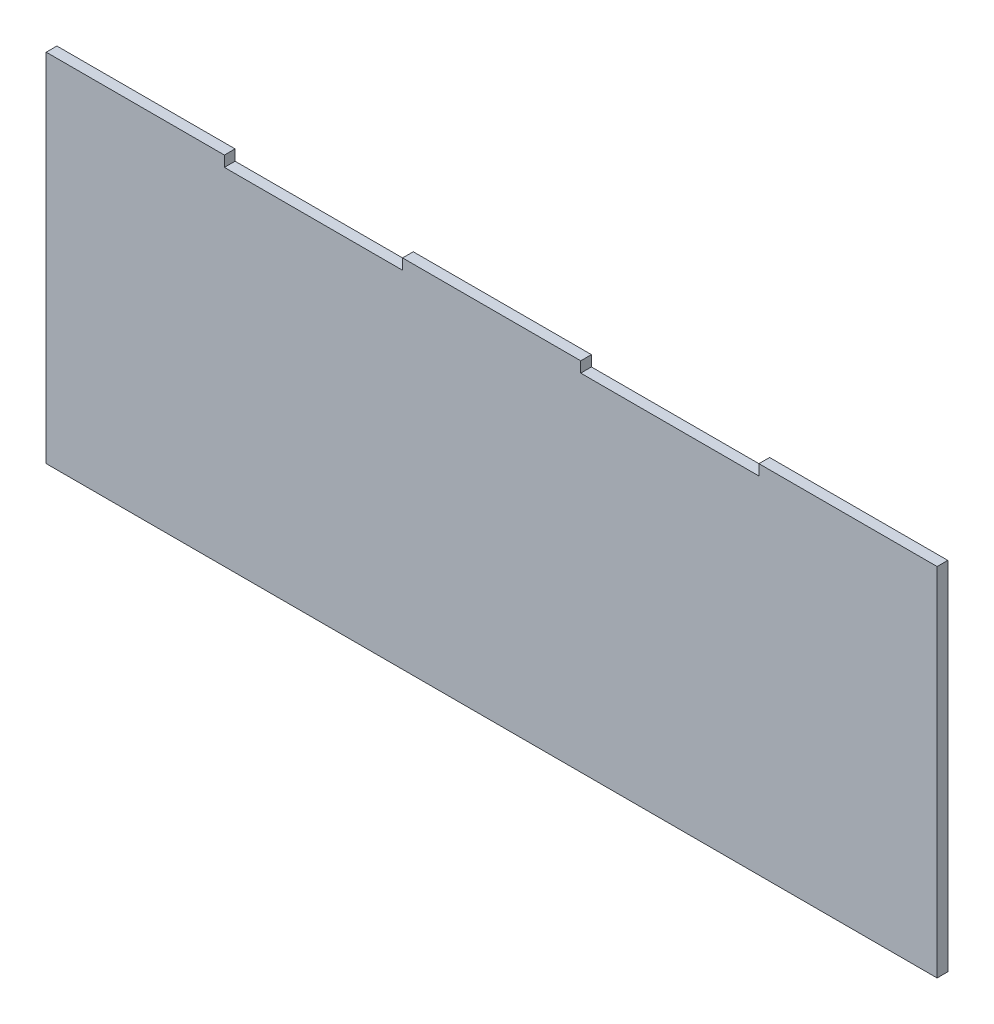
SolidWorks part; units mm, degrees
ref_plane "Front Plane" through (0, 0, 0) normal (0, 0, 1) x (1, 0, 0)
ref_plane "Top Plane" through (0, 0, 0) normal (0, 1, 0) x (1, 0, 0)
ref_plane "Right Plane" through (0, 0, 0) normal (1, 0, 0) x (0, 0, -1)
sketch "Sketch1" plane through (0, 0, 0) normal (0, 0, 1) x (1, 0, 0)
  line L0 (-394.0068, 214.0411) -> (-394.0068, 208.0411)
  line L1 (-494.0068, 214.0411) -> (-394.0068, 214.0411)
  line L2 (-494.0068, 214.0411) -> (-494.0068, 14.0411)
  line L3 (-494.0068, 14.0411) -> (5.9932, 14.0411)
  line L4 (5.9932, 214.0411) -> (5.9932, 14.0411)
  line L7 (-294.0068, 214.0411) -> (-294.0068, 208.0411)
  line L8 (-194.0068, 214.0411) -> (-194.0068, 208.0411)
  line L9 (-94.0068, 214.0411) -> (-94.0068, 208.0411)
  line L11 (-294.0068, 214.0411) -> (-194.0068, 214.0411)
  line L13 (-94.0068, 214.0411) -> (5.9932, 214.0411)
  line L18 (-94.0068, 214.0411) -> (-94.0068, 14.0411) construction
  line L20 (-194.0068, 214.0411) -> (-194.0068, 14.0411) construction
  line L21 (-194.0068, 208.0411) -> (-94.0068, 208.0411)
  line L23 (-294.0068, 214.0411) -> (-294.0068, 14.0411) construction
  line L25 (-394.0068, 214.0411) -> (-394.0068, 14.0411) construction
  line L26 (-394.0068, 208.0411) -> (-294.0068, 208.0411)
  point P0 (-244.0068, 114.0411)
  dimension "D1" = 500
  dimension "D2" = 200
  dimension "D3" = 100
  dimension "D4" = 100
  dimension "D5" = 100
  dimension "D6" = 100
extrude "Boss-Extrude1" add sketch "Sketch1" along normal blind 6
